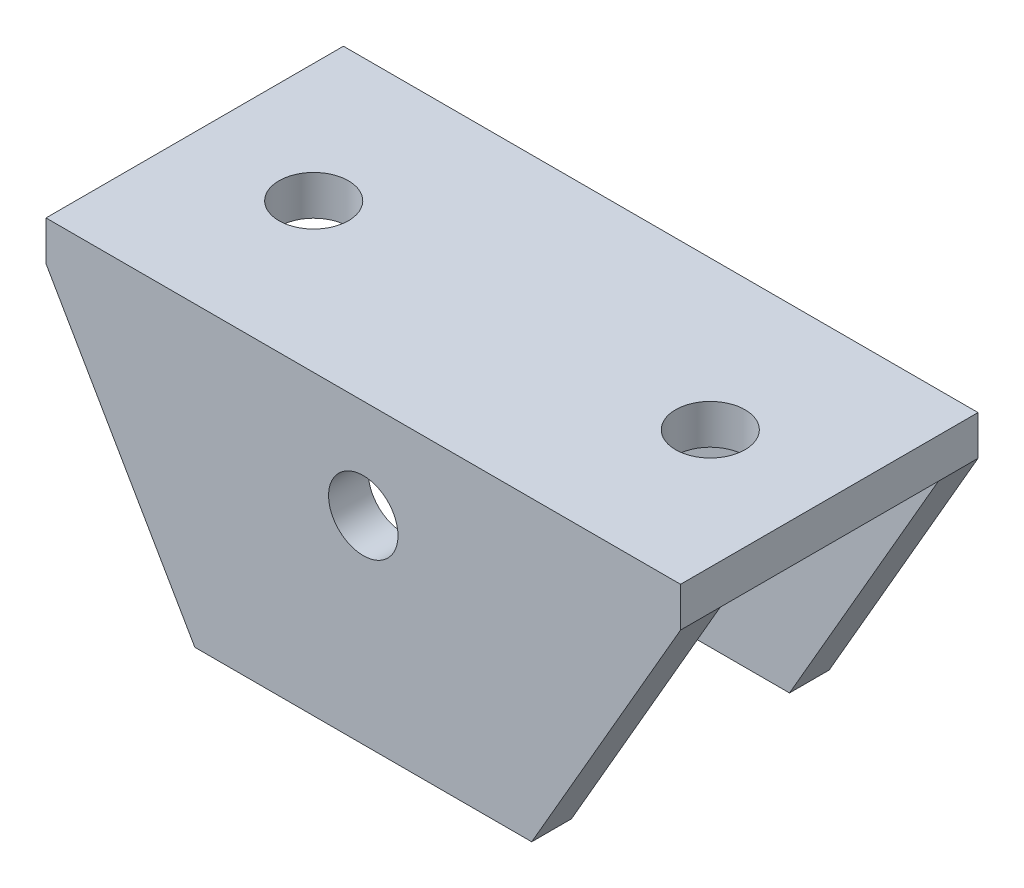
SolidWorks part; units mm, degrees
ref_plane "Front Plane" through (0, 0, 0) normal (0, 0, 1) x (1, 0, 0)
ref_plane "Top Plane" through (0, 0, 0) normal (0, 1, 0) x (1, 0, 0)
ref_plane "Right Plane" through (0, 0, 0) normal (1, 0, 0) x (0, 0, -1)
sketch "Sketch1" plane through (0, 0, 0) normal (1, 0, 0) x (0, 0, -1)
  line L0 (0, 0) -> (0, 15)
  line L1 (0, 15) -> (15, 15)
  line L2 (15, 15) -> (15, 0)
  line L3 (15, 0) -> (13, 0)
  line L4 (13, 0) -> (13, 13)
  line L5 (13, 13) -> (2, 13)
  line L6 (2, 13) -> (2, 0)
  line L7 (2, 0) -> (0, 0)
  dimension "D1" = 2
  dimension "D2" = 2
  dimension "D3" = 2
  dimension "D4" = 15
  dimension "D5" = 15
extrude "Boss-Extrude1" add sketch "Sketch1" along normal blind 32
sketch "Sketch2" plane through (0, 0, 0) normal (0, 0, 1) x (1, 0, 0)
  line L0 (7.5056, 0) -> (0, 0)
  line L1 (32, 0) -> (0, 0) construction
  line L2 (0, 0) -> (0, 13)
  line L3 (0, 13) -> (7.5056, 0)
  line L4 (32, 0) -> (24.4944, 0)
  line L5 (24.4944, 0) -> (32, 13)
  line L6 (32, 13) -> (32, 0)
  dimension "D1" = 60
  dimension "D2" = 60
extrude "Cut-Extrude1" cut sketch "Sketch2" against normal blind 32
sketch "Sketch3" plane through (0, 15, 0) normal (0, 1, 0) x (1, 0, 0)
  line L0 (0, 7.5) -> (32, 7.5) construction
  line L1 (0, 15) -> (0, 0) construction
  line L2 (32, 15) -> (32, 0) construction
  circle A0 centre (6, 7.5) radius 1.75
  circle A1 centre (26, 7.5) radius 1.75
  dimension "D1" = 20
  dimension "D2" = 3.5
  dimension "D3" = 6
extrude "Cut-Extrude2" cut sketch "Sketch3" against normal blind 32
sketch "Sketch4" plane through (0, 0, 0) normal (0, 0, 1) x (1, 0, 0)
  line L0 (16, 0) -> (16, 15) construction
  line L1 (24.4944, 0) -> (7.5056, 0) construction
  line L2 (32, 15) -> (0, 15) construction
  circle A0 centre (16, 10) radius 1.75
  dimension "D1" = 3.5
  dimension "D2" = 10
extrude "Cut-Extrude3" cut sketch "Sketch4" against normal blind 32
